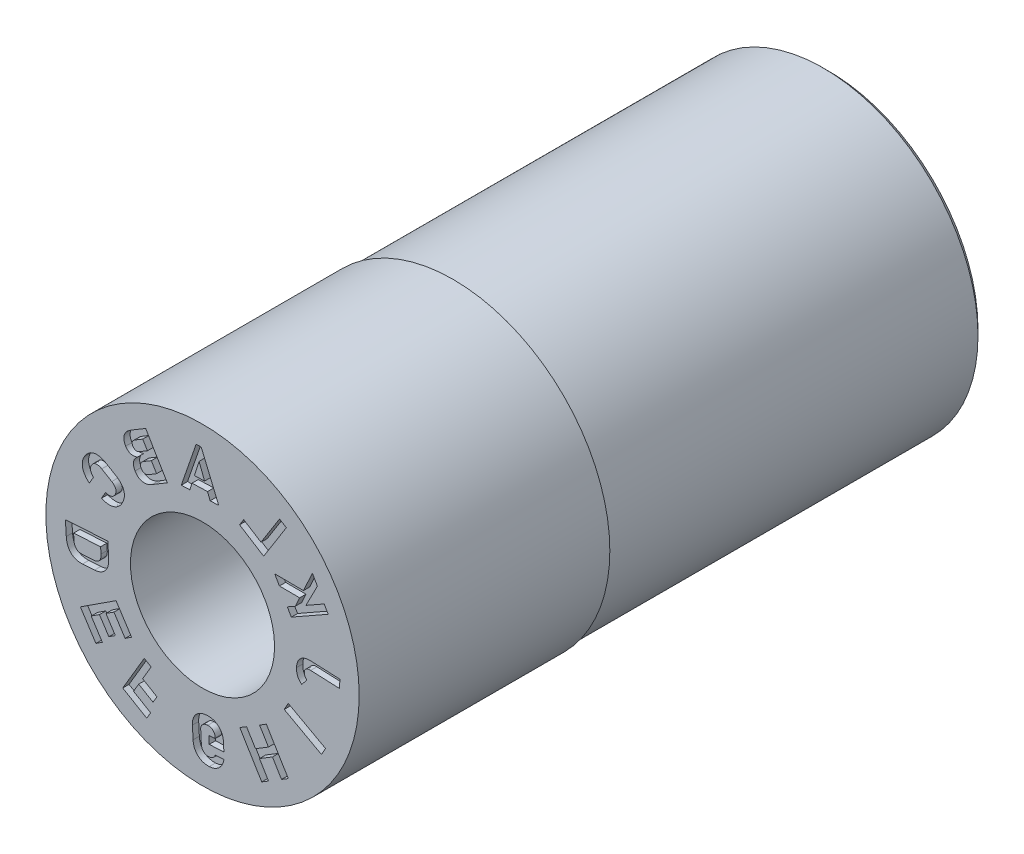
SolidWorks part; units mm, degrees
ref_plane "Front Plane" through (0, 0, 0) normal (0, 0, 1) x (1, 0, 0)
ref_plane "Top Plane" through (0, 0, 0) normal (0, 1, 0) x (1, 0, 0)
ref_plane "Right Plane" through (0, 0, 0) normal (1, 0, 0) x (0, 0, -1)
sketch "Sketch1" plane through (0, 0, 0) normal (1, 0, 0) x (0, 0, -1)
  line L2 (0, 5) -> (0, 2.3)
  line L3 (19.75, 5) -> (0, 5)
  line L4 (-3.7979, 0) -> (49996.2021, 0) construction
  line L8 (16, 1.25) -> (4, 1.25)
  line L9 (4, 2.3) -> (4, 1.25)
  line L10 (4, 2.3) -> (0, 2.3)
  line L12 (20, 2.5) -> (20, 4.75)
  line L16 (20, 4.75) -> (19.75, 5)
  line L17 (20, 2.5) -> (16, 2.5)
  line L18 (16, 1.25) -> (16, 2.5)
  dimension "D1" = 20
  dimension "D2" = 45
  dimension "D3" = 0.25
  dimension "D4" = 10
  dimension "D5" = 4.6
  dimension "D6" = 4
  dimension "D7" = 2.5
  dimension "D8" = 5
  dimension "D9" = 4
revolve "Revolve1" add sketch "Sketch1" angle 360 about L4
sketch "Sketch4" plane through (0, 0, 0) normal (1, 0, 0) x (0, 0, -1)
  line L0 (0, 0) -> (50000, 0) construction
  line L1 (20, -4.75) -> (20, 4.75) construction
  line L2 (8, 5.935) -> (20, 5.935)
  line L3 (8, 5.935) -> (8, 4.935)
  line L4 (8, 4.935) -> (20, 4.935)
  line L5 (20, 5.935) -> (20, 4.935)
  line L6 (19.75, 5) -> (0, 5) construction
  line L9 (0, 5.5) -> (0, -5.5) construction
  dimension "D1" = 1
  dimension "D2" = 0.065
  dimension "D3" = 8
revolve "Cut-Revolve1" cut sketch "Sketch4" angle 360 about L0
sketch "Sketch2" plane through (0, 0, 0) normal (0, 0, 1) x (1, 0, 0)
  line L0 (0, 0) -> (0, 5) construction
  line L1 (0, 0) -> (2.5, 4.3301) construction
  line L2 (0, 0) -> (4.3301, 2.5) construction
  line L3 (0, 0) -> (5, 0) construction
  line L4 (0, 0) -> (4.3301, -2.5) construction
  line L5 (0, 0) -> (2.5, -4.3301) construction
  line L6 (0, 0) -> (0, -5) construction
  line L7 (0, 0) -> (-2.5, -4.3301) construction
  line L8 (0, 0) -> (-4.3301, -2.5) construction
  line L9 (0, 0) -> (-5, 0) construction
  line L10 (0, 0) -> (-4.3301, 2.5) construction
  line L11 (0, 0) -> (-2.5, 4.3301) construction
  line L12 (3.3013, 1.6403) -> (3.6665, 2.3542)
  line L13 (3.6665, 2.3542) -> (3.5081, 2.6332)
  line L14 (3.5081, 2.6332) -> (3.2204, 2.0084)
  line L16 (4.0097, 1.7492) -> (3.8839, 1.9707)
  line L17 (3.8839, 1.9707) -> (3.3013, 1.6403)
  line L18 (2.7079, 1.3036) -> (2.8337, 1.0821)
  line L19 (2.8337, 1.0821) -> (4.0097, 1.7492)
  line L20 (3.1012, 1.7496) -> (2.9624, 1.448)
  line L21 (3.2204, 2.0084) -> (2.3043, 2.0155)
  line L22 (2.3043, 2.0155) -> (2.4533, 1.7524)
  line L23 (2.4533, 1.7524) -> (3.1012, 1.7496)
  line L24 (2.6748, 3.4729) -> (2.4585, 3.6091)
  line L25 (2.4585, 3.6091) -> (1.8668, 2.6693)
  line L27 (1.9519, 2.3246) -> (2.6748, 3.4729)
  line L28 (1.8668, 2.6693) -> (1.3137, 3.0174)
  line L29 (1.3137, 3.0174) -> (1.1824, 2.8088)
  line L30 (1.1824, 2.8088) -> (1.9519, 2.3246)
  line L32 (-0.0427, 4.346) -> (-0.2044, 4.3408)
  line L33 (-0.2044, 4.3408) -> (-0.6778, 2.9725)
  line L34 (-0.6778, 2.9725) -> (-0.4035, 2.9814)
  line L35 (-0.4035, 2.9814) -> (-0.3346, 3.2005)
  line L36 (-0.11, 3.915) -> (0.0666, 3.4591)
  line L37 (0.2435, 3.0023) -> (0.5176, 3.0111)
  line L38 (0.5176, 3.0111) -> (-0.0427, 4.346)
  line L39 (0.0666, 3.4591) -> (-0.2566, 3.4487)
  line L40 (-0.2566, 3.4487) -> (-0.11, 3.915)
  line L41 (-0.3346, 3.2005) -> (0.1606, 3.2165)
  line L42 (0.1606, 3.2165) -> (0.2435, 3.0023)
  line L43 (-1.466, 2.8959) -> (-1.7125, 2.7483)
  line L44 (-1.9517, 2.7921) -> (-1.9532, 2.7945)
  line L45 (-1.879, 3.0265) -> (-1.6326, 3.1741)
  line L46 (-1.6326, 3.1741) -> (-1.466, 2.8959)
  line L47 (-1.7583, 3.3842) -> (-2.0048, 3.2365)
  line L48 (-2.1531, 3.4845) -> (-1.9067, 3.6321)
  line L49 (-3.0823, -1.7751) -> (-2.8269, -1.6092)
  line L50 (-2.1706, 3.7596) -> (-2.2862, 3.6904)
  line L51 (-2.1531, 2.6307) -> (-2.1516, 2.6283)
  line L52 (-1.6078, 2.5262) -> (-1.4969, 2.5926)
  line L53 (-1.9117, -2.9939) -> (-1.6389, -2.5315)
  line L54 (-1.8148, 3.9726) -> (-2.1706, 3.7596)
  line L55 (-1.9067, 3.6321) -> (-1.7583, 3.3842)
  line L56 (-1.4969, 2.5926) -> (-1.1228, 2.8166)
  line L57 (-1.1228, 2.8166) -> (-1.8148, 3.9726)
  line L58 (-2.7609, 2.1918) -> (-3.0806, 2.3824)
  line L59 (-3.6139, 1.5628) -> (-3.4781, 1.7907)
  line L60 (-3.2163, 2.1549) -> (-2.8966, 1.9642)
  line L61 (-3.0934, 1.5612) -> (-3.2292, 1.3332)
  line L62 (-3.2525, -0.0154) -> (-3.24, -0.2137)
  line L63 (-3.4547, -0.492) -> (-3.8533, -0.5174)
  line L64 (-4.102, -0.2686) -> (-4.1146, -0.0702)
  line L65 (2.2317, -3.0836) -> (2.5218, -3.56)
  line L66 (1.6905, -3.1264) -> (1.4061, -2.6594)
  line L67 (-3.8293, -0.7812) -> (-3.4456, -0.7568)
  line L69 (2.9624, 1.448) -> (2.7079, 1.3036)
  line L70 (-4.3765, 0.1694) -> (-4.3481, -0.2783)
  line L71 (-4.1146, -0.0702) -> (-3.2525, -0.0154)
  line L72 (-2.9946, -0.1915) -> (-3.0228, 0.2554)
  line L73 (-3.0228, 0.2554) -> (-4.3765, 0.1694)
  line L75 (-3.5523, -2.0804) -> (-3.289, -1.9094)
  line L77 (-2.7595, -1.26) -> (-3.8984, -1.9998)
  line L78 (-2.8269, -1.6092) -> (-2.4707, -2.1573)
  line L79 (-2.4707, -2.1573) -> (-2.264, -2.023)
  line L80 (-2.264, -2.023) -> (-2.7595, -1.26)
  line L82 (-3.289, -1.9094) -> (-2.9888, -2.3715)
  line L83 (-2.9888, -2.3715) -> (-2.7821, -2.2371)
  line L84 (-2.7821, -2.2371) -> (-3.0823, -1.7751)
  line L86 (-3.8984, -1.9998) -> (-3.4029, -2.7628)
  line L87 (-3.4029, -2.7628) -> (-3.1961, -2.6284)
  line L88 (-3.1961, -2.6284) -> (-3.5523, -2.0804)
  line L91 (-2.2014, -3.4849) -> (-2.0365, -3.2052)
  line L92 (-1.6389, -2.5315) -> (-1.8584, -2.402)
  line L93 (-1.8584, -2.402) -> (-2.5458, -3.5671)
  line L94 (-2.0365, -3.2052) -> (-1.5788, -3.4751)
  line L95 (-1.5788, -3.4751) -> (-1.4539, -3.2638)
  line L96 (-1.4539, -3.2638) -> (-1.9117, -2.9939)
  line L98 (-2.5458, -3.5671) -> (-1.7808, -4.0184)
  line L99 (-1.7808, -4.0184) -> (-1.6558, -3.8068)
  line L100 (-1.6558, -3.8068) -> (-2.2014, -3.4849)
  line L102 (0.6823, -3.7216) -> (0.6688, -3.4575)
  line L103 (-0.3219, -3.479) -> (-0.3012, -3.8779)
  line L104 (0.6819, -3.9304) -> (0.4068, -3.9448)
  line L105 (-0.0374, -3.8643) -> (-0.058, -3.4655)
  line L106 (0.4043, -3.4677) -> (0.4056, -3.49)
  line L107 (0.4056, -3.49) -> (0.2012, -3.5006)
  line L108 (0.2012, -3.5006) -> (0.2138, -3.746)
  line L109 (0.2138, -3.746) -> (0.6823, -3.7216)
  line L110 (2.5218, -3.56) -> (2.7387, -3.4278)
  line L111 (2.7387, -3.4278) -> (2.0368, -2.2752)
  line L112 (2.0368, -2.2752) -> (1.8199, -2.4074)
  line L113 (1.8199, -2.4074) -> (2.1042, -2.8743)
  line L114 (1.8907, -3.9444) -> (2.108, -3.812)
  line L115 (2.108, -3.812) -> (1.8179, -3.3356)
  line L116 (1.4061, -2.6594) -> (1.1889, -2.7918)
  line L117 (1.1889, -2.7918) -> (1.8907, -3.9444)
  line L118 (1.8179, -3.3356) -> (2.2317, -3.0836)
  line L120 (2.1042, -2.8743) -> (1.6905, -3.1264)
  line L122 (2.7358, -1.3499) -> (2.6084, -1.582)
  line L123 (2.6084, -1.582) -> (3.7974, -2.234)
  line L124 (3.7974, -2.234) -> (3.9248, -2.0019)
  line L125 (3.9248, -2.0019) -> (2.7358, -1.3499)
  line L126 (3.1688, -0.6111) -> (3.3291, -0.4094)
  line L127 (3.4516, -0.082) -> (4.373, -0.1216)
  line L128 (4.373, -0.1216) -> (4.3843, 0.1424)
  line L129 (4.3843, 0.1424) -> (3.4618, 0.182)
  circle A0 centre (0, 0) radius 3.0592 construction
  circle A1 centre (0, 0) radius 5 construction
  spline S0 degree 3 poles (-1.7125, 2.7483) (-1.7347, 2.7351) (-1.7691, 2.7185) (-1.8171, 2.7121) (-1.8497, 2.7142) (-1.8802, 2.7236) (-1.9183, 2.7461) (-1.94, 2.7725) (-1.9517, 2.7921) knots 0 0 0 0 0.283662 0.406657 0.523425 0.636774 0.750805 1 1 1 1
  spline S1 degree 3 poles (-1.9532, 2.7945) (-1.9616, 2.8081) (-1.9712, 2.8295) (-1.9783, 2.8591) (-1.98, 2.8803) (-1.9782, 2.9011) (-1.974, 2.9215) (-1.9653, 2.941) (-1.9543, 2.9602) (-1.9396, 2.9783) (-1.916, 3.0024) (-1.8942, 3.0172) (-1.879, 3.0265) knots 0 0 0 0 0.1734 0.252448 0.328746 0.403232 0.477985 0.554153 0.633914 0.717809 0.805841 1 1 1 1
  spline S2 degree 3 poles (-2.0048, 3.2365) (-2.0251, 3.2248) (-2.0563, 3.2097) (-2.1, 3.2046) (-2.1299, 3.2071) (-2.1579, 3.2166) (-2.1936, 3.2378) (-2.213, 3.2639) (-2.2246, 3.2819) knots 0 0 0 0 0.278279 0.399346 0.515204 0.628592 0.744511 1 1 1 1
  spline S3 degree 3 poles (-2.2246, 3.2819) (-2.2342, 3.2989) (-2.2461, 3.3262) (-2.2463, 3.3645) (-2.2402, 3.3917) (-2.2275, 3.4178) (-2.201, 3.4522) (-2.1731, 3.4723) (-2.1531, 3.4845) knots 0 0 0 0 0.243607 0.354158 0.467407 0.584252 0.709017 1 1 1 1
  spline S4 degree 3 poles (-2.2862, 3.6904) (-2.3209, 3.6695) (-2.3693, 3.6353) (-2.4236, 3.5813) (-2.4557, 3.5398) (-2.481, 3.4966) (-2.4992, 3.4519) (-2.51, 3.4057) (-2.5131, 3.3584) (-2.5093, 3.3103) (-2.4934, 3.2437) (-2.4709, 3.1959) (-2.4526, 3.1652) knots 0 0 0 0 0.194845 0.282878 0.366288 0.446088 0.522465 0.597117 0.672449 0.749099 0.828057 1 1 1 1
  spline S5 degree 3 poles (-2.4526, 3.1652) (-2.4393, 3.1442) (-2.4183, 3.1138) (-2.3825, 3.0814) (-2.3546, 3.0611) (-2.3247, 3.045) (-2.2932, 3.0328) (-2.2598, 3.0255) (-2.2251, 3.0217) (-2.1891, 3.0226) (-2.1382, 3.029) (-2.1008, 3.0412) (-2.0757, 3.0504) knots 0 0 0 0 0.172363 0.25347 0.332877 0.410441 0.488121 0.566191 0.646247 0.729124 0.815081 1 1 1 1
  spline S6 degree 3 poles (-2.0757, 3.0504) (-2.0979, 3.0327) (-2.1283, 3.004) (-2.1604, 2.96) (-2.1793, 2.9263) (-2.1938, 2.8915) (-2.2026, 2.8555) (-2.2072, 2.8189) (-2.206, 2.7816) (-2.2002, 2.7439) (-2.1852, 2.6922) (-2.1679, 2.6546) (-2.1531, 2.6307) knots 0 0 0 0 0.180212 0.263729 0.345418 0.424739 0.502579 0.58005 0.658506 0.738799 0.82173 1 1 1 1
  spline S7 degree 3 poles (-2.1516, 2.6283) (-2.1328, 2.5976) (-2.1014, 2.5546) (-2.0496, 2.5088) (-2.0087, 2.4824) (-1.9652, 2.4628) (-1.9193, 2.4501) (-1.871, 2.4449) (-1.8208, 2.4472) (-1.769, 2.4564) (-1.6957, 2.4787) (-1.6425, 2.5052) (-1.6078, 2.5262) knots 0 0 0 0 0.172311 0.251803 0.328735 0.403984 0.478872 0.555354 0.634859 0.718149 0.80592 1 1 1 1
  spline S8 degree 3 poles (-2.5778, 1.5106) (-2.5652, 1.5321) (-2.5474, 1.5645) (-2.5287, 1.6091) (-2.5167, 1.6416) (-2.5073, 1.6738) (-2.4998, 1.7057) (-2.495, 1.7375) (-2.4924, 1.7689) (-2.4924, 1.7999) (-2.4941, 1.8304) (-2.4987, 1.8604) (-2.5055, 1.8898) (-2.5144, 1.9187) (-2.5256, 1.9471) (-2.539, 1.975) (-2.555, 2.0022) (-2.573, 2.0288) (-2.5935, 2.0544) (-2.616, 2.0794) (-2.6406, 2.1036) (-2.6674, 2.127) (-2.7069, 2.1575) (-2.7385, 2.1789) (-2.7609, 2.1918) knots 0 0 0 0 0.093395 0.137867 0.180685 0.222706 0.263356 0.30334 0.342595 0.381331 0.419141 0.456735 0.494484 0.53194 0.569988 0.608498 0.647681 0.687739 0.728571 0.77031 0.813445 0.857468 0.903297 1 1 1 1
  spline S9 degree 3 poles (-3.0806, 2.3824) (-3.1027, 2.3957) (-3.1362, 2.4138) (-3.1819, 2.4339) (-3.2152, 2.4465) (-3.2482, 2.4564) (-3.2808, 2.4649) (-3.3132, 2.4702) (-3.3451, 2.4736) (-3.3765, 2.4744) (-3.4075, 2.4731) (-3.4379, 2.4697) (-3.4676, 2.4637) (-3.4967, 2.4557) (-3.5252, 2.4453) (-3.5532, 2.4329) (-3.5803, 2.4178) (-3.6069, 2.4007) (-3.6327, 2.3815) (-3.6575, 2.36) (-3.6812, 2.3361) (-3.7043, 2.3103) (-3.7342, 2.2724) (-3.7545, 2.2416) (-3.7673, 2.2202) knots 0 0 0 0 0.096419 0.14217 0.186461 0.229443 0.271255 0.312127 0.351941 0.391171 0.429722 0.467793 0.505489 0.542813 0.580646 0.618521 0.657329 0.6966 0.736521 0.777346 0.819285 0.862414 0.90656 1 1 1 1
  spline S10 degree 3 poles (-3.7673, 2.2202) (-3.7878, 2.1852) (-3.8138, 2.1305) (-3.8322, 2.0534) (-3.8382, 1.9961) (-3.8366, 1.9387) (-3.8273, 1.8816) (-3.8101, 1.8252) (-3.7853, 1.7696) (-3.7534, 1.715) (-3.6994, 1.6424) (-3.6499, 1.5935) (-3.6139, 1.5628) knots 0 0 0 0 0.164359 0.242523 0.319819 0.396758 0.474197 0.553045 0.634665 0.719808 0.808406 1 1 1 1
  spline S11 degree 3 poles (-3.4781, 1.7907) (-3.4936, 1.8058) (-3.516, 1.8288) (-3.5394, 1.8631) (-3.5536, 1.8885) (-3.5641, 1.9143) (-3.5723, 1.9399) (-3.5762, 1.9657) (-3.5774, 1.9912) (-3.5755, 2.0166) (-3.5673, 2.0502) (-3.5569, 2.0743) (-3.5477, 2.0893) knots 0 0 0 0 0.195176 0.28654 0.37324 0.456219 0.536212 0.614028 0.690102 0.765908 0.841951 1 1 1 1
  spline S12 degree 3 poles (-3.5477, 2.0893) (-3.5364, 2.1086) (-3.5167, 2.1349) (-3.4851, 2.1634) (-3.4604, 2.18) (-3.4339, 2.192) (-3.406, 2.1997) (-3.3766, 2.2031) (-3.346, 2.2023) (-3.3145, 2.1966) (-3.2697, 2.1839) (-3.2376, 2.1671) (-3.2163, 2.1549) knots 0 0 0 0 0.174816 0.254583 0.331752 0.4066 0.480982 0.557388 0.636835 0.719716 0.807055 1 1 1 1
  spline S13 degree 3 poles (-2.8966, 1.9642) (-2.8755, 1.9517) (-2.8461, 1.9308) (-2.8132, 1.8981) (-2.7935, 1.8729) (-2.7783, 1.8465) (-2.7676, 1.8191) (-2.7613, 1.7908) (-2.7593, 1.7618) (-2.7619, 1.7321) (-2.772, 1.6907) (-2.7862, 1.661) (-2.7976, 1.6418) knots 0 0 0 0 0.192502 0.280292 0.362664 0.441768 0.517825 0.592476 0.667438 0.744799 0.824735 1 1 1 1
  spline S14 degree 3 poles (-2.7976, 1.6418) (-2.8069, 1.6265) (-2.8226, 1.605) (-2.8489, 1.582) (-2.8701, 1.5677) (-2.8932, 1.5564) (-2.9177, 1.5473) (-2.944, 1.5424) (-2.9716, 1.5398) (-3.0005, 1.5401) (-3.0418, 1.5454) (-3.0727, 1.5541) (-3.0934, 1.5612) knots 0 0 0 0 0.160081 0.236116 0.312169 0.388724 0.466101 0.54522 0.627432 0.713977 0.803689 1 1 1 1
  spline S15 degree 3 poles (-3.2292, 1.3332) (-3.1848, 1.3167) (-3.1181, 1.2964) (-3.0285, 1.2836) (-2.9653, 1.2815) (-2.9047, 1.2859) (-2.847, 1.2976) (-2.7926, 1.3164) (-2.7415, 1.3421) (-2.6937, 1.3742) (-2.635, 1.4275) (-2.5985, 1.4757) (-2.5778, 1.5106) knots 0 0 0 0 0.192102 0.280672 0.365808 0.447541 0.526353 0.603189 0.680187 0.757178 0.835634 1 1 1 1
  spline S16 degree 3 poles (-3.24, -0.2137) (-3.2386, -0.2335) (-3.2385, -0.2626) (-3.2426, -0.3) (-3.2475, -0.3258) (-3.2545, -0.3498) (-3.2637, -0.3722) (-3.2744, -0.3932) (-3.2878, -0.412) (-3.3025, -0.4294) (-3.3193, -0.4446) (-3.3378, -0.4576) (-3.3576, -0.4691) (-3.3796, -0.478) (-3.4119, -0.487) (-3.4372, -0.4912) (-3.4547, -0.492) knots 0 0 0 0 0.149294 0.217742 0.282769 0.345755 0.405751 0.464546 0.52215 0.57888 0.635526 0.691381 0.748399 0.807473 0.868753 1 1 1 1
  spline S17 degree 3 poles (-3.8533, -0.5174) (-3.8708, -0.5183) (-3.8966, -0.5183) (-3.9298, -0.5128) (-3.9526, -0.5066) (-3.9741, -0.4983) (-3.994, -0.4875) (-4.0125, -0.4744) (-4.0295, -0.4593) (-4.0447, -0.4419) (-4.0586, -0.4229) (-4.0701, -0.4016) (-4.0802, -0.3787) (-4.0885, -0.3539) (-4.0971, -0.3172) (-4.1007, -0.2884) (-4.102, -0.2686) knots 0 0 0 0 0.131519 0.193026 0.251708 0.30885 0.36554 0.42164 0.478419 0.536186 0.594485 0.654943 0.717185 0.782386 0.850943 1 1 1 1
  spline S18 degree 3 poles (-4.3481, -0.2783) (-4.3464, -0.3056) (-4.3422, -0.3457) (-4.3329, -0.3976) (-4.3242, -0.4342) (-4.3143, -0.4692) (-4.3021, -0.5024) (-4.2887, -0.5341) (-4.2735, -0.564) (-4.2567, -0.592) (-4.2383, -0.6183) (-4.2185, -0.6427) (-4.1969, -0.6651) (-4.174, -0.6857) (-4.1494, -0.7042) (-4.1236, -0.7212) (-4.096, -0.7358) (-4.0671, -0.7487) (-4.0369, -0.7596) (-4.0054, -0.7684) (-3.9726, -0.7751) (-3.9385, -0.7795) (-3.8906, -0.7833) (-3.854, -0.7825) (-3.8293, -0.7812) knots 0 0 0 0 0.099679 0.146986 0.192765 0.23677 0.279908 0.32155 0.362267 0.402245 0.440933 0.479288 0.516785 0.554393 0.591617 0.629153 0.667044 0.705465 0.744616 0.784244 0.824866 0.866686 0.909637 1 1 1 1
  spline S19 degree 3 poles (-3.4456, -0.7568) (-3.4221, -0.7552) (-3.3872, -0.7516) (-3.3422, -0.7418) (-3.31, -0.7335) (-3.2793, -0.7227) (-3.2496, -0.7109) (-3.2215, -0.6966) (-3.1946, -0.6808) (-3.169, -0.6632) (-3.1449, -0.6438) (-3.1228, -0.6224) (-3.1019, -0.5996) (-3.0829, -0.5747) (-3.0657, -0.548) (-3.0498, -0.5197) (-3.0359, -0.4895) (-3.0235, -0.4577) (-3.0132, -0.4243) (-3.0054, -0.3893) (-2.9988, -0.3528) (-2.9947, -0.3146) (-2.992, -0.2607) (-2.9929, -0.2195) (-2.9946, -0.1915) knots 0 0 0 0 0.086349 0.127733 0.168295 0.207935 0.246696 0.284917 0.323012 0.360849 0.398334 0.43588 0.473323 0.51131 0.550096 0.589379 0.629887 0.671531 0.713883 0.757464 0.802694 0.849518 0.897782 1 1 1 1
  spline S20 degree 3 poles (0.6688, -3.4575) (0.6679, -3.433) (0.6635, -3.3971) (0.6552, -3.3502) (0.6464, -3.3169) (0.6366, -3.2846) (0.6243, -3.2536) (0.6103, -3.2239) (0.5946, -3.1953) (0.577, -3.1683) (0.5582, -3.1427) (0.5375, -3.1192) (0.5157, -3.0969) (0.492, -3.0769) (0.467, -3.0583) (0.4406, -3.0413) (0.4125, -3.0264) (0.3833, -3.0133) (0.3531, -3.0016) (0.3217, -2.9926) (0.2893, -2.9856) (0.256, -2.98) (0.2096, -2.9763) (0.1743, -2.9757) (0.1505, -2.9773) knots 0 0 0 0 0.092097 0.136211 0.179282 0.221701 0.263437 0.304593 0.345671 0.386224 0.42581 0.465274 0.504135 0.54305 0.582251 0.621436 0.661363 0.701669 0.742217 0.783216 0.824693 0.866914 0.910217 1 1 1 1
  spline S21 degree 3 poles (0.1505, -2.9773) (0.1265, -2.9782) (0.0912, -2.9824) (0.0452, -2.9908) (0.0124, -2.999) (-0.0192, -3.009) (-0.0495, -3.0208) (-0.0789, -3.0342) (-0.1068, -3.0496) (-0.1334, -3.0667) (-0.1587, -3.0848) (-0.1818, -3.105) (-0.2037, -3.126) (-0.2234, -3.149) (-0.2418, -3.1731) (-0.2586, -3.1987) (-0.2732, -3.2258) (-0.2863, -3.2541) (-0.2977, -3.2833) (-0.3065, -3.3137) (-0.3138, -3.3449) (-0.3189, -3.377) (-0.3232, -3.4218) (-0.3231, -3.456) (-0.3219, -3.479) knots 0 0 0 0 0.092708 0.137257 0.180688 0.223164 0.265201 0.306518 0.347867 0.388514 0.428457 0.467954 0.507099 0.545772 0.584963 0.624108 0.663987 0.70393 0.744417 0.785028 0.826231 0.868082 0.910763 1 1 1 1
  spline S22 degree 3 poles (-0.3012, -3.8779) (-0.3003, -3.9023) (-0.296, -3.9383) (-0.2877, -3.9851) (-0.2789, -4.0184) (-0.2691, -4.0508) (-0.2568, -4.0817) (-0.2429, -4.1114) (-0.2271, -4.1398) (-0.2095, -4.1665) (-0.1907, -4.192) (-0.1702, -4.2156) (-0.1481, -4.2376) (-0.1247, -4.258) (-0.0995, -4.2762) (-0.0731, -4.2932) (-0.0452, -4.3084) (-0.0159, -4.3216) (0.0144, -4.3328) (0.0457, -4.3419) (0.078, -4.349) (0.1112, -4.3544) (0.1576, -4.3583) (0.1929, -4.3589) (0.2167, -4.3572) knots 0 0 0 0 0.092204 0.13637 0.179491 0.22196 0.263744 0.304949 0.345757 0.38605 0.425682 0.465193 0.503831 0.543042 0.582057 0.621287 0.661455 0.701807 0.742251 0.783298 0.824494 0.867099 0.910112 1 1 1 1
  spline S23 degree 3 poles (0.2167, -4.3572) (0.2558, -4.3556) (0.3134, -4.3462) (0.3864, -4.3216) (0.4376, -4.2972) (0.485, -4.267) (0.5286, -4.2319) (0.5674, -4.1916) (0.6016, -4.1467) (0.6306, -4.0976) (0.6618, -4.0265) (0.6765, -3.9695) (0.6819, -3.9304) knots 0 0 0 0 0.170673 0.253471 0.33582 0.417619 0.498386 0.579483 0.661511 0.744468 0.827803 1 1 1 1
  spline S24 degree 3 poles (0.4068, -3.9448) (0.4027, -3.9588) (0.3952, -3.9797) (0.379, -4.0042) (0.3653, -4.0215) (0.3492, -4.0369) (0.3314, -4.0503) (0.3126, -4.0628) (0.2919, -4.0726) (0.2705, -4.0807) (0.241, -4.0893) (0.2181, -4.0921) (0.2028, -4.0931) knots 0 0 0 0 0.163455 0.244229 0.325903 0.408113 0.491213 0.573955 0.659013 0.744804 0.829004 1 1 1 1
  spline S25 degree 3 poles (0.2028, -4.0931) (0.1815, -4.0941) (0.1496, -4.0929) (0.1095, -4.0818) (0.0818, -4.0704) (0.0564, -4.0551) (0.0337, -4.0365) (0.0139, -4.0144) (-0.0033, -3.9895) (-0.0168, -3.9614) (-0.0319, -3.9203) (-0.0357, -3.8868) (-0.0374, -3.8643) knots 0 0 0 0 0.172173 0.253423 0.332967 0.412052 0.4903 0.568352 0.64925 0.732831 0.817999 1 1 1 1
  spline S26 degree 3 poles (-0.058, -3.4655) (-0.0594, -3.4454) (-0.0573, -3.4157) (-0.047, -3.3781) (-0.0356, -3.3522) (-0.0206, -3.3286) (-0.0028, -3.3071) (0.0189, -3.289) (0.0432, -3.2733) (0.0702, -3.2605) (0.1102, -3.2469) (0.1424, -3.243) (0.1643, -3.2414) knots 0 0 0 0 0.169385 0.249139 0.328273 0.406733 0.484577 0.563071 0.6442 0.728311 0.814246 1 1 1 1
  spline S27 degree 3 poles (0.1643, -3.2414) (0.186, -3.2404) (0.2181, -3.2416) (0.2587, -3.2517) (0.2864, -3.2628) (0.3116, -3.2775) (0.3344, -3.2952) (0.354, -3.317) (0.3709, -3.3416) (0.3843, -3.3695) (0.3988, -3.4111) (0.403, -3.4448) (0.4043, -3.4677) knots 0 0 0 0 0.174321 0.255811 0.335717 0.412952 0.489703 0.567216 0.647166 0.729162 0.81493 1 1 1 1
  spline S28 degree 3 poles (2.9995, -0.2302) (2.9978, -0.2697) (3.001, -0.3282) (3.018, -0.4028) (3.0372, -0.454) (3.0617, -0.5012) (3.1021, -0.5574) (3.1404, -0.5923) (3.1688, -0.6111) knots 0 0 0 0 0.271973 0.400312 0.525574 0.647267 0.765611 1 1 1 1
  spline S29 degree 3 poles (3.3291, -0.4094) (3.3155, -0.3981) (3.2974, -0.3788) (3.278, -0.3496) (3.2662, -0.3264) (3.2569, -0.3023) (3.2487, -0.2692) (3.2466, -0.2438) (3.2476, -0.2269) knots 0 0 0 0 0.255231 0.381316 0.506998 0.632723 0.755324 1 1 1 1
  spline S30 degree 3 poles (3.2476, -0.2269) (3.2485, -0.2049) (3.2551, -0.1718) (3.2798, -0.1359) (3.3038, -0.1142) (3.3337, -0.098) (3.383, -0.0831) (3.4235, -0.0805) (3.4516, -0.082) knots 0 0 0 0 0.235579 0.344935 0.456481 0.574963 0.702365 1 1 1 1
  spline S31 degree 3 poles (3.4618, 0.182) (3.4182, 0.1842) (3.3544, 0.181) (3.2735, 0.1632) (3.2284, 0.1463) (3.1949, 0.1298) (3.1717, 0.1157) (3.1494, 0.1007) (3.1292, 0.0834) (3.1101, 0.0651) (3.0922, 0.0453) (3.0761, 0.0237) (3.0612, 0.0009) (3.0481, -0.0235) (3.0364, -0.0491) (3.0264, -0.0761) (3.0178, -0.1043) (3.0108, -0.1339) (3.0035, -0.1759) (3.0005, -0.2083) (2.9995, -0.2302) knots 0 0 0 0 0.185997 0.270621 0.35164 0.390622 0.429278 0.467346 0.504968 0.542395 0.580108 0.618424 0.656924 0.69617 0.736012 0.777014 0.8186 0.861699 0.906468 1 1 1 1
  point P20 (0, 0)
  dimension "D1" = 12
extrude "Cut-Extrude1" cut sketch "Sketch2" against normal blind 0.2
sketch "Sketch3" plane through (0, 0, -4) normal (0, 0, 1) x (1, 0, 0)
  line L0 (0, 0) -> (0, 50000) construction
  line L1 (0.7217, 1.25) -> (-0.7217, 1.25)
  line L2 (-0.7217, 1.25) -> (-1.4434, 0)
  line L3 (-1.4434, 0) -> (-0.7217, -1.25)
  line L4 (-0.7217, -1.25) -> (0.7217, -1.25)
  line L5 (0.7217, -1.25) -> (1.4434, 0)
  line L6 (1.4434, 0) -> (0.7217, 1.25)
  line L7 (0, 0) -> (50000, 0) construction
  circle A0 centre (0, 0) radius 1.25 construction
  circle A1 centre (0, 0) radius 1.25 construction
extrude "Cut-Extrude2" cut sketch "Sketch3" against normal blind 2
